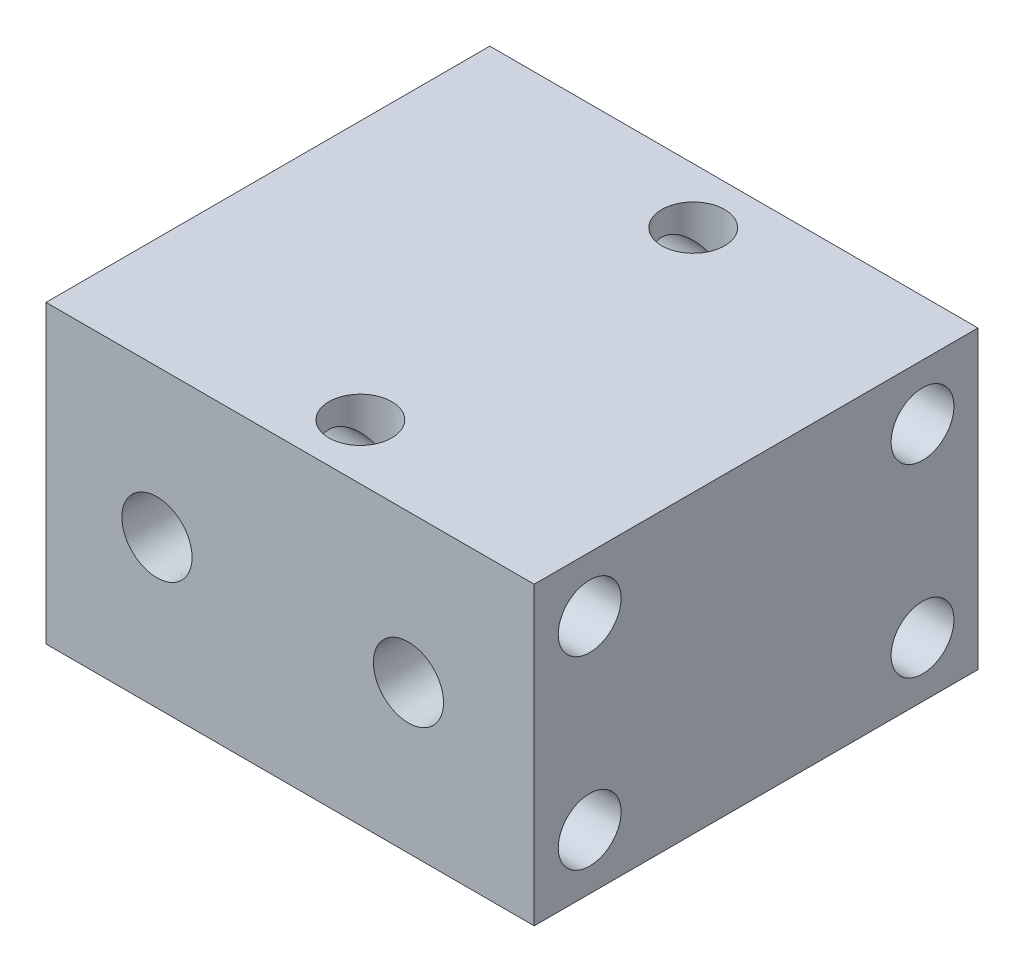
SolidWorks part; units mm, degrees
ref_plane "Front Plane" through (0, 0, 0) normal (0, 0, 1) x (1, 0, 0)
ref_plane "Top Plane" through (0, 0, 0) normal (0, 1, 0) x (1, 0, 0)
ref_plane "Right Plane" through (0, 0, 0) normal (1, 0, 0) x (0, 0, -1)
sketch "Sketch1" plane through (0, 0, 0) normal (0, 1, 0) x (1, 0, 0)
  line L0 (2, 22.5) -> (2, -22.5) construction
  line L1 (-33, 30) -> (33, 30)
  line L2 (-33, 30) -> (-33, -30)
  line L3 (-33, -30) -> (33, -30)
  line L4 (33, 30) -> (33, -30)
  line L5 (-33, 0) -> (2, 0) construction
  circle A0 centre (2, 22.5) radius 4.25
  circle A1 centre (2, -22.5) radius 4.25
  dimension "D5" = 8.5
  dimension "D6" = 8.5
  dimension "D8" = 35
  dimension "D1" = 60
  dimension "D2" = 30
  dimension "D3" = 66
  dimension "D4" = 33
  dimension "D7" = 45
extrude "Extrude1" add sketch "Sketch1" along normal blind 40
sketch "Sketch2" plane through (-33, 0, 0) normal (-1, 0, 0) x (0, 0, 1)
  line L0 (0, 0) -> (0, 20) construction
  line L1 (30, 20) -> (0, 20) construction
  line L2 (30, 40) -> (30, 0) construction
  circle A0 centre (0, 20) radius 0.5
  dimension "D1" = 1
extrude "Cut-Extrude1" cut sketch "Sketch2" against normal blind 10
hole_wizard "1/8 NPT Tapped Hole1" positions "Sketch4" profile "Sketch3" size "1/8" standard "Ansi Inch"
sketch "Sketch4" plane through (0, 0, 30) normal (0, 0, 1) x (1, 0, 0)
  line L0 (-33, 20) -> (33, 20) construction
  line L1 (-33, 40) -> (-33, 0) construction
  line L2 (33, 40) -> (33, 0) construction
  point P0 (16, 20)
  point P1 (-18, 20)
  dimension "D1" = 15
  dimension "D2" = 17
sketch "Sketch3" plane through (16, 20, 30) normal (1, 0, 0) x (0, -1, 0)
  line L0 (0, 0) -> (0, 14.1535)
  line L1 (4.2164, 11.62) -> (0, 14.1535)
  line L2 (-4.2164, 11.62) -> (0, 14.1535) construction
  line L3 (4.2164, 11.62) -> (4.2164, 6.92)
  line L4 (4.2164, 6.92) -> (4.5374, 6.92)
  line L5 (4.5374, 6.92) -> (4.7446, 0)
  line L6 (-4.5374, 6.92) -> (-4.7446, 0) construction
  line L7 (4.7446, 0) -> (0, 0)
  line L8 (0, -6.35) -> (0, 107.95) construction
  line L11 (-4.2164, 6.92) -> (-4.5374, 6.92) construction
  dimension "Tap Drill Dia." = 8.4328
  dimension "Tap Drill Depth" = 11.62
  dimension "Thread Dia." = 9.4892
  dimension "Thread Angle" = 3.43
  dimension "Thread Depth" = 6.92
  dimension "Drill Angle" = 118
sketch "Sketch5" plane through (0, 0, 30) normal (0, 0, 1) x (1, 0, 0)
  circle A0 centre (-18, 20) radius 2
  circle A1 centre (16, 20) radius 2
  circle A2 centre (16, 20) radius 4.7446 construction
  circle A3 centre (-18, 20) radius 4.7446 construction
  dimension "D1" = 4
  dimension "D2" = 4
extrude "Cut-Extrude2" cut sketch "Sketch5" against normal blind 20
sketch "Sketch6" plane through (-33, 0, 0) normal (-1, 0, 0) x (0, 0, 1)
  line L0 (-22.5, 40) -> (-22.5, 0) construction
  line L1 (22.5, 40) -> (22.5, 0) construction
  line L3 (-22.5, 32.5) -> (22.5, 32.5) construction
  line L5 (-22.5, 7.5) -> (22.5, 7.5) construction
  circle A0 centre (-22.5, 32.5) radius 4.25
  circle A1 centre (-22.5, 7.5) radius 4.25
  circle A2 centre (22.5, 32.5) radius 4.25
  circle A3 centre (22.5, 7.5) radius 4.25
  dimension "D3" = 8.5
  dimension "D1" = 12.5
  dimension "D2" = 25
extrude "Cut-Extrude3" cut sketch "Sketch6" against normal up to surface (66 mm away)
